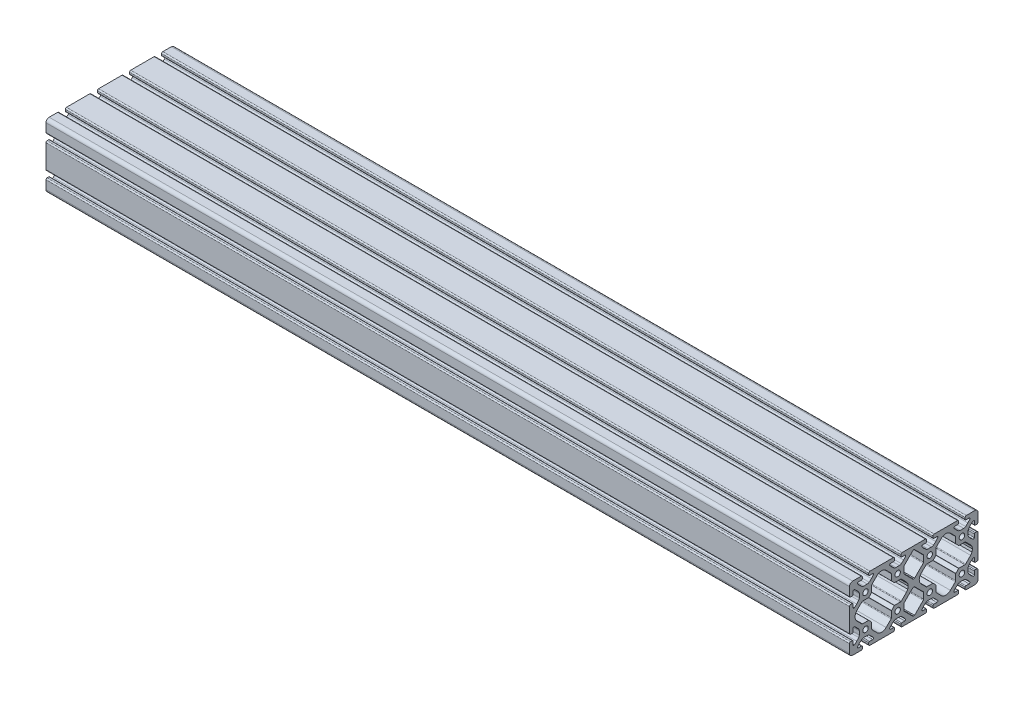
SolidWorks part; units mm, degrees
ref_plane "Ebene vorne" through (0, 0, 0) normal (0, 0, 1) x (1, 0, 0)
ref_plane "Ebene oben" through (0, 0, 0) normal (0, 1, 0) x (1, 0, 0)
ref_plane "Ebene rechts" through (0, 0, 0) normal (1, 0, 0) x (0, 0, -1)
sketch "Skizze1" plane through (0, 0, 0) normal (0, 1, 0) x (1, 0, 0)
  line L0 (0, 0) -> (1000, 0)
  dimension "D1" = 1000
other "Strukturbauteil1"
ref_plane "Ebene1" through (0, 0, 0) normal (1, 0, 0) x (0, 0, -1)
sketch "Model" plane through (0, 0, 0) normal (1, 0, 0) x (0, 0, -1)
  line L0 (-11.8107, 24.6538) -> (-1.0607, 35.4038)
  line L2 (-1.0607, 35.4038) -> (0, 35.8431)
  line L3 (-1.0607, 4.5962) -> (0, 4.1569)
  line L4 (-1.0607, 4.5962) -> (-11.8107, 15.3462)
  line L5 (-12.25, 16.4069) -> (-12.25, 23.5931)
  line L6 (-9.1924, 5.6569) -> (-7.4582, 3.0615)
  line L7 (-7.4582, 3.0615) -> (-6.8492, 0)
  line L8 (-70.8076, 5.6569) -> (-72.5418, 3.0615)
  line L9 (-72.5418, 3.0615) -> (-73.1508, 0)
  line L10 (-73.7733, 10.2112) -> (-70.9636, 12.6212)
  line L11 (-70.9636, 12.6212) -> (-68.5405, 15.4197)
  line L12 (-52.3964, 15.8878) -> (-55.8878, 12.3964)
  line L13 (-56.2414, 12.25) -> (-63.5931, 12.25)
  line L14 (-64.6538, 11.8107) -> (-70.8076, 5.6569)
  line L15 (-68.5405, 24.5803) -> (-70.9636, 27.3788)
  line L16 (-70.9636, 27.3788) -> (-73.7733, 29.7888)
  line L17 (-69.7888, 33.7733) -> (-67.3788, 30.9636)
  line L18 (-67.3788, 30.9636) -> (-64.5803, 28.5405)
  line L19 (-55.4197, 28.5405) -> (-52.6212, 30.9636)
  line L20 (-52.6212, 30.9636) -> (-50.2112, 33.7733)
  line L21 (-29.7888, 33.7733) -> (-27.3788, 30.9636)
  line L22 (-27.3788, 30.9636) -> (-24.5803, 28.5405)
  line L23 (-15.4197, 28.5405) -> (-12.6212, 30.9636)
  line L24 (-12.6212, 30.9636) -> (-10.2112, 33.7733)
  line L25 (-9.1924, 5.6569) -> (-15.3462, 11.8107)
  line L26 (-16.4069, 12.25) -> (-23.7586, 12.25)
  line L27 (-24.1122, 12.3964) -> (-27.6036, 15.8878)
  line L28 (-27.75, 16.2414) -> (-27.75, 23.5931)
  line L29 (-28.1893, 24.6538) -> (-34.3431, 30.8076)
  line L30 (-45.6569, 30.8076) -> (-51.8107, 24.6538)
  line L31 (-52.25, 23.5931) -> (-52.25, 16.2414)
  line L32 (-80, -40) -> (80, -40) construction
  line L33 (80, 14.5) -> (80, -14.5)
  line L34 (76.5, 16) -> (78.5, 16)
  line L35 (75.5, 11.0839) -> (75.5, 15)
  line L36 (67.75, 22.1931) -> (67.75, 17.8069)
  line L37 (75.5, 25) -> (75.5, 28.9161)
  line L38 (78.5, 24) -> (76.5, 24)
  line L39 (80, 36) -> (80, 25.5)
  line L40 (65.5, 40) -> (76, 40)
  line L41 (64, 36.5) -> (64, 38.5)
  line L42 (68.9161, 35.5) -> (65, 35.5)
  line L43 (57.8069, 27.75) -> (62.1931, 27.75)
  line L44 (55, 35.5) -> (51.0839, 35.5)
  line L45 (56, 38.5) -> (56, 36.5)
  line L46 (25.5, 40) -> (54.5, 40)
  line L47 (24, 36.5) -> (24, 38.5)
  line L48 (28.9161, 35.5) -> (25, 35.5)
  line L49 (17.8069, 27.75) -> (22.1931, 27.75)
  line L50 (15, 35.5) -> (11.0839, 35.5)
  line L51 (16, 38.5) -> (16, 36.5)
  line L52 (52.25, 23.5931) -> (52.25, 16.2414)
  line L53 (45.6569, 30.8076) -> (51.8107, 24.6538)
  line L54 (28.1893, 24.6538) -> (34.3431, 30.8076)
  line L55 (27.75, 16.2414) -> (27.75, 23.5931)
  line L56 (24.1122, 12.3964) -> (27.6036, 15.8878)
  line L57 (16.4069, 12.25) -> (23.7586, 12.25)
  line L58 (9.1924, 5.6569) -> (15.3462, 11.8107)
  line L59 (12.6212, 30.9636) -> (10.2112, 33.7733)
  line L60 (15.4197, 28.5405) -> (12.6212, 30.9636)
  line L61 (27.3788, 30.9636) -> (24.5803, 28.5405)
  line L62 (29.7888, 33.7733) -> (27.3788, 30.9636)
  line L63 (52.6212, 30.9636) -> (50.2112, 33.7733)
  line L64 (55.4197, 28.5405) -> (52.6212, 30.9636)
  line L65 (67.3788, 30.9636) -> (64.5803, 28.5405)
  line L66 (69.7888, 33.7733) -> (67.3788, 30.9636)
  line L67 (70.9636, 27.3788) -> (73.7733, 29.7888)
  line L68 (68.5405, 24.5803) -> (70.9636, 27.3788)
  line L69 (64.6538, 11.8107) -> (70.8076, 5.6569)
  line L70 (56.2414, 12.25) -> (63.5931, 12.25)
  line L71 (52.3964, 15.8878) -> (55.8878, 12.3964)
  line L72 (70.9636, 12.6212) -> (68.5405, 15.4197)
  line L73 (73.7733, 10.2112) -> (70.9636, 12.6212)
  line L74 (72.5418, 3.0615) -> (73.1508, 0)
  line L75 (70.8076, 5.6569) -> (72.5418, 3.0615)
  line L76 (7.4582, 3.0615) -> (6.8492, 0)
  line L77 (9.1924, 5.6569) -> (7.4582, 3.0615)
  line L78 (12.25, 16.4069) -> (12.25, 23.5931)
  line L79 (1.0607, 4.5962) -> (11.8107, 15.3462)
  line L80 (1.0607, 4.5962) -> (0, 4.1569)
  line L81 (1.0607, 35.4038) -> (0, 35.8431)
  line L82 (11.8107, 24.6538) -> (1.0607, 35.4038)
  line L83 (-76.5, -16) -> (-78.5, -16)
  line L84 (-75.5, -11.0839) -> (-75.5, -15)
  line L85 (-67.75, -22.1931) -> (-67.75, -17.8069)
  line L86 (-75.5, -25) -> (-75.5, -28.9161)
  line L87 (-78.5, -24) -> (-76.5, -24)
  line L88 (14.5, 40) -> (-14.5, 40)
  line L89 (-16, 38.5) -> (-16, 36.5)
  line L90 (-15, 35.5) -> (-11.0839, 35.5)
  line L91 (-17.8069, 27.75) -> (-22.1931, 27.75)
  line L92 (-28.9161, 35.5) -> (-25, 35.5)
  line L93 (-24, 36.5) -> (-24, 38.5)
  line L94 (-25.5, 40) -> (-54.5, 40)
  line L95 (-56, 38.5) -> (-56, 36.5)
  line L96 (-55, 35.5) -> (-51.0839, 35.5)
  line L97 (-57.8069, 27.75) -> (-62.1931, 27.75)
  line L98 (-68.9161, 35.5) -> (-65, 35.5)
  line L99 (-64, 36.5) -> (-64, 38.5)
  line L100 (-65.5, 40) -> (-76, 40)
  line L101 (-80, 36) -> (-80, 25.5)
  line L102 (-78.5, 24) -> (-76.5, 24)
  line L103 (-75.5, 25) -> (-75.5, 28.9161)
  line L104 (-67.75, 22.1931) -> (-67.75, 17.8069)
  line L105 (-75.5, 11.0839) -> (-75.5, 15)
  line L106 (-76.5, 16) -> (-78.5, 16)
  line L107 (-80, 14.5) -> (-80, -14.5)
  line L108 (-80, -36) -> (-80, -25.5)
  line L109 (-65.5, -40) -> (-76, -40)
  line L110 (-64, -36.5) -> (-64, -38.5)
  line L111 (-68.9161, -35.5) -> (-65, -35.5)
  line L112 (-57.8069, -27.75) -> (-62.1931, -27.75)
  line L113 (-55, -35.5) -> (-51.0839, -35.5)
  line L114 (-56, -38.5) -> (-56, -36.5)
  line L115 (-25.5, -40) -> (-54.5, -40)
  line L116 (-24, -36.5) -> (-24, -38.5)
  line L117 (-28.9161, -35.5) -> (-25, -35.5)
  line L118 (-17.8069, -27.75) -> (-22.1931, -27.75)
  line L119 (-15, -35.5) -> (-11.0839, -35.5)
  line L120 (-16, -38.5) -> (-16, -36.5)
  line L121 (14.5, -40) -> (-14.5, -40)
  line L122 (11.8107, -24.6538) -> (1.0607, -35.4038)
  line L123 (1.0607, -35.4038) -> (0, -35.8431)
  line L124 (1.0607, -4.5962) -> (0, -4.1569)
  line L125 (1.0607, -4.5962) -> (11.8107, -15.3462)
  line L126 (12.25, -16.4069) -> (12.25, -23.5931)
  line L127 (9.1924, -5.6569) -> (7.4582, -3.0615)
  line L128 (7.4582, -3.0615) -> (6.8492, 0)
  line L129 (70.8076, -5.6569) -> (72.5418, -3.0615)
  line L130 (72.5418, -3.0615) -> (73.1508, 0)
  line L131 (73.7733, -10.2112) -> (70.9636, -12.6212)
  line L132 (70.9636, -12.6212) -> (68.5405, -15.4197)
  line L133 (52.3964, -15.8878) -> (55.8878, -12.3964)
  line L134 (56.2414, -12.25) -> (63.5931, -12.25)
  line L135 (64.6538, -11.8107) -> (70.8076, -5.6569)
  line L136 (68.5405, -24.5803) -> (70.9636, -27.3788)
  line L137 (70.9636, -27.3788) -> (73.7733, -29.7888)
  line L138 (69.7888, -33.7733) -> (67.3788, -30.9636)
  line L139 (67.3788, -30.9636) -> (64.5803, -28.5405)
  line L140 (55.4197, -28.5405) -> (52.6212, -30.9636)
  line L141 (52.6212, -30.9636) -> (50.2112, -33.7733)
  line L142 (29.7888, -33.7733) -> (27.3788, -30.9636)
  line L143 (27.3788, -30.9636) -> (24.5803, -28.5405)
  line L144 (15.4197, -28.5405) -> (12.6212, -30.9636)
  line L145 (12.6212, -30.9636) -> (10.2112, -33.7733)
  line L146 (9.1924, -5.6569) -> (15.3462, -11.8107)
  line L147 (16.4069, -12.25) -> (23.7586, -12.25)
  line L148 (24.1122, -12.3964) -> (27.6036, -15.8878)
  line L149 (27.75, -16.2414) -> (27.75, -23.5931)
  line L150 (28.1893, -24.6538) -> (34.3431, -30.8076)
  line L151 (45.6569, -30.8076) -> (51.8107, -24.6538)
  line L152 (52.25, -23.5931) -> (52.25, -16.2414)
  line L153 (16, -38.5) -> (16, -36.5)
  line L154 (15, -35.5) -> (11.0839, -35.5)
  line L155 (17.8069, -27.75) -> (22.1931, -27.75)
  line L156 (28.9161, -35.5) -> (25, -35.5)
  line L157 (24, -36.5) -> (24, -38.5)
  line L158 (25.5, -40) -> (54.5, -40)
  line L159 (56, -38.5) -> (56, -36.5)
  line L160 (55, -35.5) -> (51.0839, -35.5)
  line L161 (57.8069, -27.75) -> (62.1931, -27.75)
  line L162 (68.9161, -35.5) -> (65, -35.5)
  line L163 (64, -36.5) -> (64, -38.5)
  line L164 (65.5, -40) -> (76, -40)
  line L165 (80, -36) -> (80, -25.5)
  line L166 (78.5, -24) -> (76.5, -24)
  line L167 (75.5, -25) -> (75.5, -28.9161)
  line L168 (67.75, -22.1931) -> (67.75, -17.8069)
  line L169 (75.5, -11.0839) -> (75.5, -15)
  line L170 (76.5, -16) -> (78.5, -16)
  line L171 (-52.25, -23.5931) -> (-52.25, -16.2414)
  line L172 (-45.6569, -30.8076) -> (-51.8107, -24.6538)
  line L173 (-28.1893, -24.6538) -> (-34.3431, -30.8076)
  line L174 (-27.75, -16.2414) -> (-27.75, -23.5931)
  line L175 (-24.1122, -12.3964) -> (-27.6036, -15.8878)
  line L176 (-16.4069, -12.25) -> (-23.7586, -12.25)
  line L177 (-9.1924, -5.6569) -> (-15.3462, -11.8107)
  line L178 (-12.6212, -30.9636) -> (-10.2112, -33.7733)
  line L179 (-15.4197, -28.5405) -> (-12.6212, -30.9636)
  line L180 (-27.3788, -30.9636) -> (-24.5803, -28.5405)
  line L181 (-29.7888, -33.7733) -> (-27.3788, -30.9636)
  line L182 (-52.6212, -30.9636) -> (-50.2112, -33.7733)
  line L183 (-55.4197, -28.5405) -> (-52.6212, -30.9636)
  line L184 (-67.3788, -30.9636) -> (-64.5803, -28.5405)
  line L185 (-69.7888, -33.7733) -> (-67.3788, -30.9636)
  line L186 (-70.9636, -27.3788) -> (-73.7733, -29.7888)
  line L187 (-68.5405, -24.5803) -> (-70.9636, -27.3788)
  line L188 (-64.6538, -11.8107) -> (-70.8076, -5.6569)
  line L189 (-56.2414, -12.25) -> (-63.5931, -12.25)
  line L190 (-52.3964, -15.8878) -> (-55.8878, -12.3964)
  line L191 (-70.9636, -12.6212) -> (-68.5405, -15.4197)
  line L192 (-73.7733, -10.2112) -> (-70.9636, -12.6212)
  line L193 (-72.5418, -3.0615) -> (-73.1508, 0)
  line L194 (-70.8076, -5.6569) -> (-72.5418, -3.0615)
  line L195 (-7.4582, -3.0615) -> (-6.8492, 0)
  line L196 (-9.1924, -5.6569) -> (-7.4582, -3.0615)
  line L197 (-12.25, -16.4069) -> (-12.25, -23.5931)
  line L198 (-1.0607, -4.5962) -> (-11.8107, -15.3462)
  line L199 (-1.0607, -4.5962) -> (0, -4.1569)
  line L200 (-1.0607, -35.4038) -> (0, -35.8431)
  line L201 (-11.8107, -24.6538) -> (-1.0607, -35.4038)
  line L202 (-80, -40) -> (-80, 40) construction
  line L203 (-80, 40) -> (80, 40) construction
  line L204 (80, -40) -> (80, 40) construction
  line L205 (-80, -40) -> (80, 40) construction
  line L206 (-80, 40) -> (80, -40) construction
  arc A0 (78.5, 16) -> (80, 14.5) centre (78.5, 14.5) cw
  arc A1 (75.5, 15) -> (76.5, 16) centre (76.5, 15) cw
  circle A2 centre (-60, 20) radius 3.4
  circle A3 centre (-20, 20) radius 3.4
  arc A4 (75.5, 11.0839) -> (73.7733, 10.2112) centre (74.4161, 11.0839) cw
  arc A5 (68.5405, 15.4197) -> (67.75, 17.8069) centre (71.75, 17.8069) cw
  arc A6 (67.75, 22.1931) -> (68.5405, 24.5803) centre (71.75, 22.1931) cw
  arc A7 (73.7733, 29.7888) -> (75.5, 28.9161) centre (74.4161, 28.9161) cw
  arc A8 (-11.8107, 24.6538) -> (-12.25, 23.5931) centre (-10.75, 23.5931) ccw
  arc A9 (76.5, 24) -> (75.5, 25) centre (76.5, 25) cw
  arc A10 (80, 25.5) -> (78.5, 24) centre (78.5, 25.5) cw
  arc A11 (76, 40) -> (80, 36) centre (76, 36) cw
  arc A12 (64, 38.5) -> (65.5, 40) centre (65.5, 38.5) cw
  arc A13 (-12.25, 16.4069) -> (-11.8107, 15.3462) centre (-10.75, 16.4069) ccw
  arc A14 (65, 35.5) -> (64, 36.5) centre (65, 36.5) cw
  arc A15 (68.9161, 35.5) -> (69.7888, 33.7733) centre (68.9161, 34.4161) cw
  arc A16 (64.5803, 28.5405) -> (62.1931, 27.75) centre (62.1931, 31.75) cw
  arc A17 (57.8069, 27.75) -> (55.4197, 28.5405) centre (57.8069, 31.75) cw
  arc A18 (50.2112, 33.7733) -> (51.0839, 35.5) centre (51.0839, 34.4161) cw
  arc A19 (56, 36.5) -> (55, 35.5) centre (55, 36.5) cw
  arc A20 (-52.3964, 15.8878) -> (-52.25, 16.2414) centre (-52.75, 16.2414) ccw
  arc A21 (-56.2414, 12.25) -> (-55.8878, 12.3964) centre (-56.2414, 12.75) ccw
  arc A22 (-63.5931, 12.25) -> (-64.6538, 11.8107) centre (-63.5931, 10.75) ccw
  arc A23 (54.5, 40) -> (56, 38.5) centre (54.5, 38.5) cw
  arc A24 (24, 38.5) -> (25.5, 40) centre (25.5, 38.5) cw
  arc A25 (25, 35.5) -> (24, 36.5) centre (25, 36.5) cw
  arc A26 (28.9161, 35.5) -> (29.7888, 33.7733) centre (28.9161, 34.4161) cw
  arc A27 (24.5803, 28.5405) -> (22.1931, 27.75) centre (22.1931, 31.75) cw
  arc A28 (17.8069, 27.75) -> (15.4197, 28.5405) centre (17.8069, 31.75) cw
  arc A29 (10.2112, 33.7733) -> (11.0839, 35.5) centre (11.0839, 34.4161) cw
  arc A30 (16, 36.5) -> (15, 35.5) centre (15, 36.5) cw
  arc A31 (14.5, 40) -> (16, 38.5) centre (14.5, 38.5) cw
  arc A32 (51.8107, 24.6538) -> (52.25, 23.5931) centre (50.75, 23.5931) cw
  arc A33 (34.3431, 30.8076) -> (45.6569, 30.8076) centre (40, 25.1508) cw
  arc A34 (-15.3462, 11.8107) -> (-16.4069, 12.25) centre (-16.4069, 10.75) ccw
  arc A35 (-24.1122, 12.3964) -> (-23.7586, 12.25) centre (-23.7586, 12.75) ccw
  arc A36 (-27.75, 16.2414) -> (-27.6036, 15.8878) centre (-27.25, 16.2414) ccw
  arc A37 (-27.75, 23.5931) -> (-28.1893, 24.6538) centre (-29.25, 23.5931) ccw
  arc A38 (-34.3431, 30.8076) -> (-45.6569, 30.8076) centre (-40, 25.1508) ccw
  arc A39 (-51.8107, 24.6538) -> (-52.25, 23.5931) centre (-50.75, 23.5931) ccw
  arc A40 (27.75, 23.5931) -> (28.1893, 24.6538) centre (29.25, 23.5931) cw
  arc A41 (27.75, 16.2414) -> (27.6036, 15.8878) centre (27.25, 16.2414) cw
  arc A42 (24.1122, 12.3964) -> (23.7586, 12.25) centre (23.7586, 12.75) cw
  arc A43 (15.3462, 11.8107) -> (16.4069, 12.25) centre (16.4069, 10.75) cw
  arc A44 (63.5931, 12.25) -> (64.6538, 11.8107) centre (63.5931, 10.75) cw
  arc A45 (56.2414, 12.25) -> (55.8878, 12.3964) centre (56.2414, 12.75) cw
  arc A46 (52.3964, 15.8878) -> (52.25, 16.2414) centre (52.75, 16.2414) cw
  arc A47 (12.25, 16.4069) -> (11.8107, 15.3462) centre (10.75, 16.4069) cw
  arc A48 (11.8107, 24.6538) -> (12.25, 23.5931) centre (10.75, 23.5931) cw
  circle A49 centre (20, 20) radius 3.4
  circle A50 centre (60, 20) radius 3.4
  arc A51 (-78.5, -16) -> (-80, -14.5) centre (-78.5, -14.5) cw
  arc A52 (-75.5, -15) -> (-76.5, -16) centre (-76.5, -15) cw
  arc A53 (-75.5, -11.0839) -> (-73.7733, -10.2112) centre (-74.4161, -11.0839) cw
  arc A54 (-68.5405, -15.4197) -> (-67.75, -17.8069) centre (-71.75, -17.8069) cw
  arc A55 (-67.75, -22.1931) -> (-68.5405, -24.5803) centre (-71.75, -22.1931) cw
  arc A56 (-73.7733, -29.7888) -> (-75.5, -28.9161) centre (-74.4161, -28.9161) cw
  arc A57 (-76.5, -24) -> (-75.5, -25) centre (-76.5, -25) cw
  arc A58 (-80, -25.5) -> (-78.5, -24) centre (-78.5, -25.5) cw
  arc A59 (-76, -40) -> (-80, -36) centre (-76, -36) cw
  arc A60 (-64, -38.5) -> (-65.5, -40) centre (-65.5, -38.5) cw
  arc A61 (-65, -35.5) -> (-64, -36.5) centre (-65, -36.5) cw
  arc A62 (-68.9161, -35.5) -> (-69.7888, -33.7733) centre (-68.9161, -34.4161) cw
  arc A63 (-64.5803, -28.5405) -> (-62.1931, -27.75) centre (-62.1931, -31.75) cw
  arc A64 (-57.8069, -27.75) -> (-55.4197, -28.5405) centre (-57.8069, -31.75) cw
  arc A65 (-50.2112, -33.7733) -> (-51.0839, -35.5) centre (-51.0839, -34.4161) cw
  arc A66 (-56, -36.5) -> (-55, -35.5) centre (-55, -36.5) cw
  arc A67 (-54.5, -40) -> (-56, -38.5) centre (-54.5, -38.5) cw
  arc A68 (-24, -38.5) -> (-25.5, -40) centre (-25.5, -38.5) cw
  arc A69 (-25, -35.5) -> (-24, -36.5) centre (-25, -36.5) cw
  arc A70 (-28.9161, -35.5) -> (-29.7888, -33.7733) centre (-28.9161, -34.4161) cw
  arc A71 (-24.5803, -28.5405) -> (-22.1931, -27.75) centre (-22.1931, -31.75) cw
  arc A72 (-17.8069, -27.75) -> (-15.4197, -28.5405) centre (-17.8069, -31.75) cw
  arc A73 (-10.2112, -33.7733) -> (-11.0839, -35.5) centre (-11.0839, -34.4161) cw
  arc A74 (-16, -36.5) -> (-15, -35.5) centre (-15, -36.5) cw
  arc A75 (-14.5, -40) -> (-16, -38.5) centre (-14.5, -38.5) cw
  circle A76 centre (60, -20) radius 3.4
  circle A77 centre (20, -20) radius 3.4
  arc A78 (11.8107, -24.6538) -> (12.25, -23.5931) centre (10.75, -23.5931) ccw
  arc A79 (12.25, -16.4069) -> (11.8107, -15.3462) centre (10.75, -16.4069) ccw
  arc A80 (52.3964, -15.8878) -> (52.25, -16.2414) centre (52.75, -16.2414) ccw
  arc A81 (56.2414, -12.25) -> (55.8878, -12.3964) centre (56.2414, -12.75) ccw
  arc A82 (63.5931, -12.25) -> (64.6538, -11.8107) centre (63.5931, -10.75) ccw
  arc A83 (15.3462, -11.8107) -> (16.4069, -12.25) centre (16.4069, -10.75) ccw
  arc A84 (24.1122, -12.3964) -> (23.7586, -12.25) centre (23.7586, -12.75) ccw
  arc A85 (27.75, -16.2414) -> (27.6036, -15.8878) centre (27.25, -16.2414) ccw
  arc A86 (27.75, -23.5931) -> (28.1893, -24.6538) centre (29.25, -23.5931) ccw
  arc A87 (-51.8107, -24.6538) -> (-52.25, -23.5931) centre (-50.75, -23.5931) cw
  arc A88 (-34.3431, -30.8076) -> (-45.6569, -30.8076) centre (-40, -25.1508) cw
  arc A89 (-27.75, -23.5931) -> (-28.1893, -24.6538) centre (-29.25, -23.5931) cw
  arc A90 (-27.75, -16.2414) -> (-27.6036, -15.8878) centre (-27.25, -16.2414) cw
  arc A91 (-24.1122, -12.3964) -> (-23.7586, -12.25) centre (-23.7586, -12.75) cw
  arc A92 (-15.3462, -11.8107) -> (-16.4069, -12.25) centre (-16.4069, -10.75) cw
  arc A93 (34.3431, -30.8076) -> (45.6569, -30.8076) centre (40, -25.1508) ccw
  arc A94 (51.8107, -24.6538) -> (52.25, -23.5931) centre (50.75, -23.5931) ccw
  arc A95 (14.5, -40) -> (16, -38.5) centre (14.5, -38.5) ccw
  arc A96 (16, -36.5) -> (15, -35.5) centre (15, -36.5) ccw
  arc A97 (10.2112, -33.7733) -> (11.0839, -35.5) centre (11.0839, -34.4161) ccw
  arc A98 (17.8069, -27.75) -> (15.4197, -28.5405) centre (17.8069, -31.75) ccw
  arc A99 (24.5803, -28.5405) -> (22.1931, -27.75) centre (22.1931, -31.75) ccw
  arc A100 (28.9161, -35.5) -> (29.7888, -33.7733) centre (28.9161, -34.4161) ccw
  arc A101 (25, -35.5) -> (24, -36.5) centre (25, -36.5) ccw
  arc A102 (24, -38.5) -> (25.5, -40) centre (25.5, -38.5) ccw
  arc A103 (54.5, -40) -> (56, -38.5) centre (54.5, -38.5) ccw
  arc A104 (-63.5931, -12.25) -> (-64.6538, -11.8107) centre (-63.5931, -10.75) cw
  arc A105 (-56.2414, -12.25) -> (-55.8878, -12.3964) centre (-56.2414, -12.75) cw
  arc A106 (-52.3964, -15.8878) -> (-52.25, -16.2414) centre (-52.75, -16.2414) cw
  arc A107 (56, -36.5) -> (55, -35.5) centre (55, -36.5) ccw
  arc A108 (50.2112, -33.7733) -> (51.0839, -35.5) centre (51.0839, -34.4161) ccw
  arc A109 (57.8069, -27.75) -> (55.4197, -28.5405) centre (57.8069, -31.75) ccw
  arc A110 (64.5803, -28.5405) -> (62.1931, -27.75) centre (62.1931, -31.75) ccw
  arc A111 (68.9161, -35.5) -> (69.7888, -33.7733) centre (68.9161, -34.4161) ccw
  arc A112 (65, -35.5) -> (64, -36.5) centre (65, -36.5) ccw
  arc A113 (-12.25, -16.4069) -> (-11.8107, -15.3462) centre (-10.75, -16.4069) cw
  arc A114 (64, -38.5) -> (65.5, -40) centre (65.5, -38.5) ccw
  arc A115 (76, -40) -> (80, -36) centre (76, -36) ccw
  arc A116 (80, -25.5) -> (78.5, -24) centre (78.5, -25.5) ccw
  arc A117 (76.5, -24) -> (75.5, -25) centre (76.5, -25) ccw
  arc A118 (-11.8107, -24.6538) -> (-12.25, -23.5931) centre (-10.75, -23.5931) cw
  arc A119 (73.7733, -29.7888) -> (75.5, -28.9161) centre (74.4161, -28.9161) ccw
  arc A120 (67.75, -22.1931) -> (68.5405, -24.5803) centre (71.75, -22.1931) ccw
  arc A121 (68.5405, -15.4197) -> (67.75, -17.8069) centre (71.75, -17.8069) ccw
  arc A122 (75.5, -11.0839) -> (73.7733, -10.2112) centre (74.4161, -11.0839) ccw
  circle A123 centre (-20, -20) radius 3.4
  circle A124 centre (-60, -20) radius 3.4
  arc A125 (75.5, -15) -> (76.5, -16) centre (76.5, -15) ccw
  arc A126 (78.5, -16) -> (80, -14.5) centre (78.5, -14.5) ccw
  arc A133 (-14.5, 40) -> (-16, 38.5) centre (-14.5, 38.5) ccw
  arc A134 (-16, 36.5) -> (-15, 35.5) centre (-15, 36.5) ccw
  arc A135 (-10.2112, 33.7733) -> (-11.0839, 35.5) centre (-11.0839, 34.4161) ccw
  arc A137 (-17.8069, 27.75) -> (-15.4197, 28.5405) centre (-17.8069, 31.75) ccw
  arc A138 (-24.5803, 28.5405) -> (-22.1931, 27.75) centre (-22.1931, 31.75) ccw
  arc A140 (-28.9161, 35.5) -> (-29.7888, 33.7733) centre (-28.9161, 34.4161) ccw
  arc A141 (-25, 35.5) -> (-24, 36.5) centre (-25, 36.5) ccw
  arc A142 (-24, 38.5) -> (-25.5, 40) centre (-25.5, 38.5) ccw
  arc A143 (-54.5, 40) -> (-56, 38.5) centre (-54.5, 38.5) ccw
  arc A144 (-56, 36.5) -> (-55, 35.5) centre (-55, 36.5) ccw
  arc A145 (-50.2112, 33.7733) -> (-51.0839, 35.5) centre (-51.0839, 34.4161) ccw
  arc A147 (-57.8069, 27.75) -> (-55.4197, 28.5405) centre (-57.8069, 31.75) ccw
  arc A148 (-64.5803, 28.5405) -> (-62.1931, 27.75) centre (-62.1931, 31.75) ccw
  arc A150 (-68.9161, 35.5) -> (-69.7888, 33.7733) centre (-68.9161, 34.4161) ccw
  arc A151 (-65, 35.5) -> (-64, 36.5) centre (-65, 36.5) ccw
  arc A152 (-64, 38.5) -> (-65.5, 40) centre (-65.5, 38.5) ccw
  arc A153 (-76, 40) -> (-80, 36) centre (-76, 36) ccw
  arc A154 (-80, 25.5) -> (-78.5, 24) centre (-78.5, 25.5) ccw
  arc A155 (-76.5, 24) -> (-75.5, 25) centre (-76.5, 25) ccw
  arc A156 (-73.7733, 29.7888) -> (-75.5, 28.9161) centre (-74.4161, 28.9161) ccw
  arc A158 (-67.75, 22.1931) -> (-68.5405, 24.5803) centre (-71.75, 22.1931) ccw
  arc A159 (-68.5405, 15.4197) -> (-67.75, 17.8069) centre (-71.75, 17.8069) ccw
  arc A161 (-75.5, 11.0839) -> (-73.7733, 10.2112) centre (-74.4161, 11.0839) ccw
  arc A162 (-75.5, 15) -> (-76.5, 16) centre (-76.5, 15) ccw
  arc A163 (-78.5, 16) -> (-80, 14.5) centre (-78.5, 14.5) ccw
  point P12 (0, 0)
  point P167 (0, 40)
  point P481 (-80, 0)
  point P496 (0, 0)
  point P497 (80, 0)
  point P510 (0, -40)
  point P512 (0, 0)
